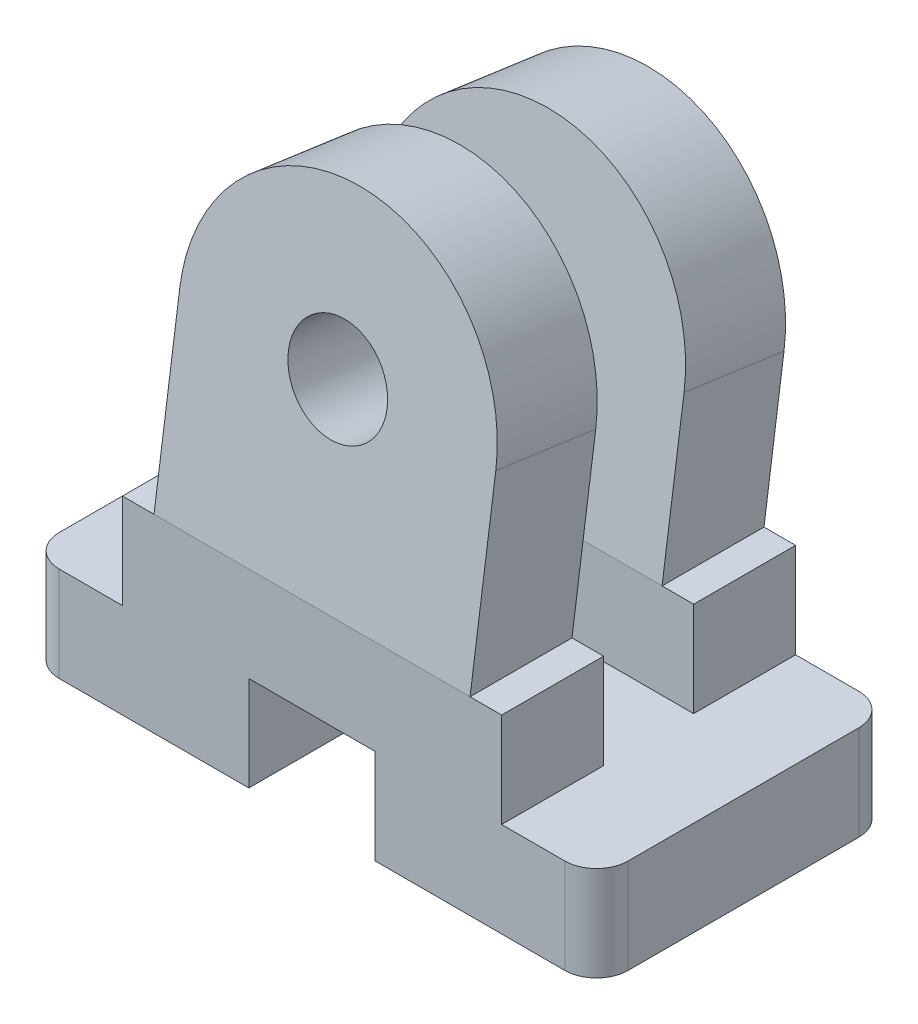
SolidWorks part; units mm, degrees
ref_plane "Front Plane" through (0, 0, 0) normal (0, 0, 1) x (1, 0, 0)
ref_plane "Top Plane" through (0, 0, 0) normal (0, 1, 0) x (1, 0, 0)
ref_plane "Right Plane" through (0, 0, 0) normal (1, 0, 0) x (0, 0, -1)
sketch "Sketch1" plane through (0, 0, 0) normal (0, 1, 0) x (1, 0, 0)
  line L1 (-9, 4.65) -> (9, 4.65)
  line L2 (-9, 4.65) -> (-9, -4.65)
  line L3 (-9, -4.65) -> (9, -4.65)
  line L4 (9, 4.65) -> (9, -4.65)
  dimension "D1" = 9.3
  dimension "D2" = 18
  dimension "D3" = 4.65
  dimension "D4" = 9
extrude "Base" add sketch "Sketch1" along normal blind 3
sketch "Sketch2" plane through (0, 3, 0) normal (0, 1, 0) x (1, 0, 0)
  line L0 (0, 0) -> (-3.9389, 0) construction
  line L1 (9, 4.65) -> (-9, 4.65) construction
  line L2 (-6, 4.65) -> (6, 4.65)
  line L3 (-6, 4.65) -> (-6, 1.425)
  line L4 (-6, 1.425) -> (6, 1.425)
  line L5 (6, 4.65) -> (6, 1.425)
  line L6 (6, -4.65) -> (6, -1.425)
  line L7 (-6, -1.425) -> (6, -1.425)
  line L8 (-6, -4.65) -> (-6, -1.425)
  line L9 (-6, -4.65) -> (6, -4.65)
  dimension "D1" = 12
  dimension "D2" = 6
  dimension "D3" = 1.425
extrude "Base Mid" add sketch "Sketch2" along normal blind 3
sketch "Sketch3" plane through (0, 0, 0) normal (1, 0, 0) x (0, 0, -1)
  line L0 (-4.65, 6) -> (-3.1406, 16.7399)
  line L1 (-3.1406, 16.7399) -> (0.0219, 16.2955)
  line L2 (0.0219, 16.2955) -> (-1.425, 6)
  line L3 (-1.425, 6) -> (-4.65, 6)
  line L4 (1.425, 6) -> (2.8167, 15.9027)
  line L5 (2.8167, 15.9027) -> (5.9793, 15.4582)
  line L6 (5.9793, 15.4582) -> (4.65, 6)
  line L7 (-4.65, 6) -> (-4.65, 11.3081) construction
  line L10 (1.425, 6) -> (4.65, 6)
  line L11 (4.65, 6) -> (4.6455, 5.0133)
  dimension "D1" = 8
  dimension "D4" = 10
extrude "Pulley Head" add sketch "Sketch3" along normal blind 5 and the other way blind 5
sketch "Sketch4" plane through (0, 0.7571, 5.3868) normal (0, 0.1392, 0.9903) x (1, 0, 0)
  line L0 (5, 5.2945) -> (5, 16.1399) construction
  line L1 (-5, 16.1399) -> (5, 16.1399) construction
  line L2 (-5, 11.1399) -> (-5, 17.4187)
  line L3 (-5, 5.2945) -> (-5, 16.1399) construction
  line L4 (-5, 17.4187) -> (5, 17.4187)
  line L5 (5, 17.4187) -> (5, 11.1399)
  circle A0 centre (0, 11.1399) radius 1.5625
  arc A1 (5, 11.1399) -> (-5, 11.1399) centre (0, 11.1399) ccw
  point P0 (0, 11.1399)
  dimension "D3" = 3.125
  dimension "D1" = 5
  dimension "D2" = 5
extrude "Frame" cut sketch "Sketch4" against normal through all contours A0 | A1 L4 M4 | A1 M2 M3
sketch "Sketch5" plane through (0, 0, 0) normal (0, -1, 0) x (1, 0, 0)
  line L0 (0, 4.65) -> (0, -4.65) construction
  line L1 (-9, 4.65) -> (9, 4.65) construction
  line L2 (9, -4.65) -> (-9, -4.65) construction
  line L4 (-2, 4.65) -> (2, 4.65)
  line L5 (-2, 4.65) -> (-2, -4.65)
  line L6 (-2, -4.65) -> (2, -4.65)
  line L7 (2, 4.65) -> (2, -4.65)
  dimension "D1" = 4
extrude "Base Slot" cut sketch "Sketch5" against normal up to surface (3 mm away)
fillet "Corner Allowances" radius 1 4 edges at (-9, 1.5, -4.65) (-9, 1.5, 4.65) (9, 1.5, -4.65) (9, 1.5, 4.65)
ref_point "Ref Center"
equation "\"D4@Sketch1\"=\"D2@Sketch1\"/2"
equation "\"D3@Sketch1\"=\"D1@Sketch1\"/2"
equation "\"D2@Sketch2\"=\"D1@Sketch2\"/2"
equation "\"D3@Sketch2\"=(\"pulley thickness@values@params.sldprt\"+\"print free@values@params.sldprt\")/2"
equation "\"D1@Base\"=\"width keep@values@params.sldprt\""
equation "\"D1@Base Mid\"=\"width keep@values@params.sldprt\""
